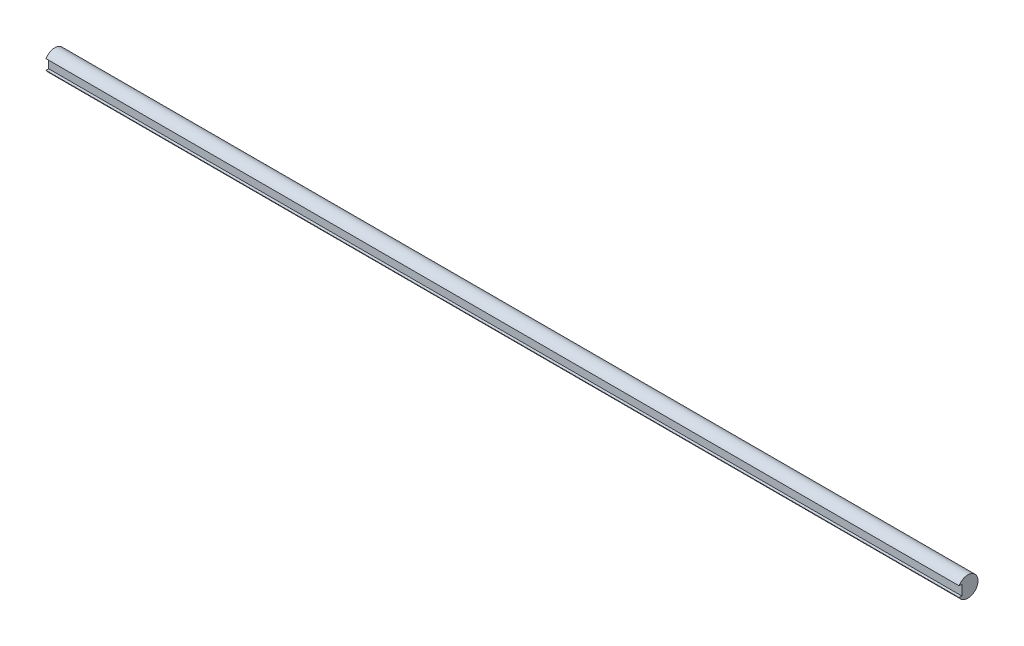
SolidWorks part; units mm, degrees
ref_plane "Front Plane" through (0, 0, 0) normal (0, 0, 1) x (1, 0, 0)
ref_plane "Top Plane" through (0, 0, 0) normal (0, 1, 0) x (1, 0, 0)
ref_plane "Right Plane" through (0, 0, 0) normal (1, 0, 0) x (0, 0, -1)
sketch "Sketch1" plane through (0, 0, 0) normal (1, 0, 0) x (0, 0, -1)
  circle A0 centre (0, 0) radius 5
  dimension "D1" = 10
extrude "main" add sketch "Sketch1" along normal mid plane 450
sketch "Sketch2" plane through (0, 0, 0) normal (1, 0, 0) x (0, 0, -1)
  line L1 (-5, -2.5) -> (-3, -2.5)
  line L2 (-5, -2.5) -> (-5, 2.5)
  line L3 (-5, 2.5) -> (-3, 2.5)
  line L4 (-3, -2.5) -> (-3, 2.5)
  line L5 (-5, -2.5) -> (-3, 2.5) construction
  line L6 (-5, 2.5) -> (-3, -2.5) construction
  circle A2 centre (0, 0) radius 5 construction
  point P0 (-4, 0)
  dimension "D1" = 5
  dimension "D2" = 2
extrude "fluke mount cutout" cut sketch "Sketch2" against normal through all and the other way through all
